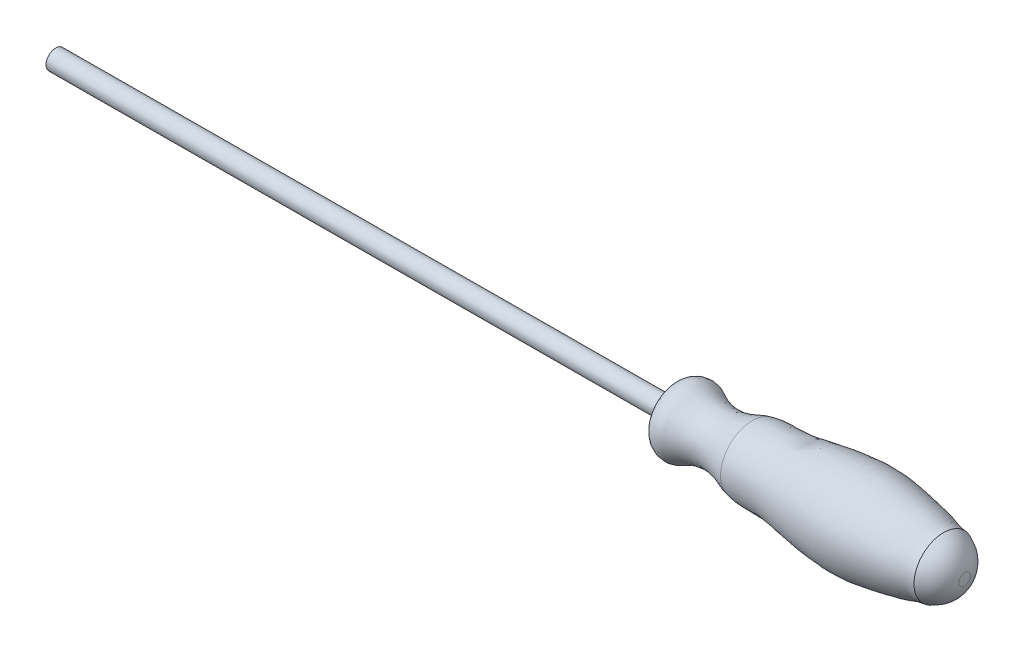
SolidWorks part; units mm, degrees
ref_plane "Front" through (0, 0, 0) normal (0, 0, 1) x (1, 0, 0)
ref_plane "Top" through (0, 0, 0) normal (0, 1, 0) x (1, 0, 0)
ref_plane "Right" through (0, 0, 0) normal (1, 0, 0) x (0, 0, -1)
sketch "Esquisse1" plane through (0, 0, 0) normal (0, 0, 1) x (1, 0, 0)
  line L0 (-5.4706, 0.3329) -> (111.2269, -11.1094) construction
  line L1 (0, 0) -> (0, -3.4014)
  line L2 (0, 0) -> (203.8198, 0.9847) construction
  line L4 (0, 0) -> (112, 0.5411)
  spline S0 degree 2 poles (0, -3.4014) (-0.1556, -7.1644) (0.5454, -10.8775) knots 0 0 0 1 1 1
  spline S1 degree 3 poles (0.5454, -10.8775) (1.3703, -11.9744) (3.3226, -12.8302) (6.1946, -12.9244) (8.2173, -11.8859) (10.5137, -10.6745) (13.2815, -9.8087) (16.632, -9.2235) (20.2629, -9.326) (24.1568, -10.1634) (27.1906, -11.5587) (29.1633, -12.0599) (29.7779, -12.2061) knots 0 0 0 0 0.120356 0.182103 0.252494 0.320379 0.416926 0.51167 0.625759 0.741662 0.867963 0.924774 0.924774 0.924774 0.924774
  spline S2 degree 3 poles (29.7779, -12.2061) (31.1346, -12.4504) (33.1676, -12.8911) (36.3876, -12.9051) (39.1715, -12.8799) (42.6259, -12.9791) (46.218, -13.347) (49.9167, -14.0068) (53.6218, -14.6405) (57.2662, -15.1744) (61.1202, -15.6812) (65.1405, -15.9976) (69.272, -16.4214) (73.6066, -16.3521) (77.7839, -16.2162) (81.9902, -15.5316) (86.3141, -14.804) (91.8474, -13.8515) (97.7509, -12.539) (101.9294, -10.9604) (103.8184, -10.9882) knots 0 0 0 0 0.055398 0.082677 0.128818 0.167035 0.221097 0.273334 0.317568 0.371734 0.420941 0.473294 0.533363 0.587168 0.646878 0.700632 0.757711 0.822668 0.925589 1 1 1 1
  spline S3 degree 3 poles (103.8184, -10.9882) (105.3866, -10.3956) (109.2102, -8.227) (111.463, -4.2308) (111.9223, -1.6522) knots 0 0 0 0 0.390825 1 1 1 1
  spline S8 degree 2 poles (112, 0.5411) (112.0053, -0.5553) (111.9223, -1.6522) knots 0.5 0.5 0.5 1 1 1
  point P4 (69.7283, -16.1677)
  point P17 (73.8825, -16.1677)
  point P30 (77.9798, -15.8262)
  point P34 (64.9481, -15.9969)
  point P36 (73.9963, -16.4522)
  point P38 (77.9229, -16.1107)
  point P40 (81.9064, -15.5417)
  point P42 (69.5576, -16.3953)
  point P44 (73.8758, -16.4365)
  point P46 (69.4314, -16.3439)
  point P48 (73.4592, -16.3439)
  dimension "D1" = 112
revolve "Révolution2" add sketch "Esquisse1" angle 360 about L4
ref_plane "Plan1" through (-0.0164, -0.0001, 0) normal (1, 0.0048, 0) x (0, 0, -1)
sketch "Esquisse3" plane through (-0.0164, -0.0001, 0) normal (1, 0.0048, 0) x (0, 0, -1)
  circle A0 centre (0, 0) radius 3.75
  dimension "D1" = 7.5
extrude "Boss.-Extru.1" add sketch "Esquisse3" against normal blind 240
